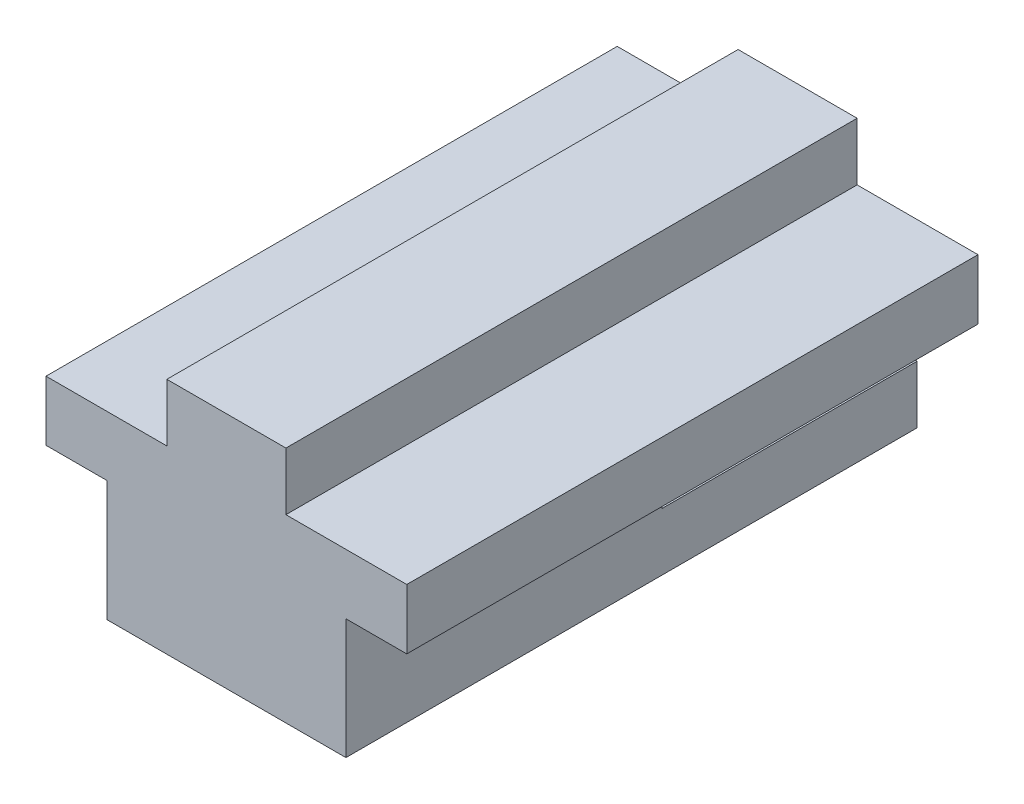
SolidWorks part; units mm, degrees
ref_plane "Front Plane" through (0, 0, 0) normal (0, 0, 1) x (1, 0, 0)
ref_plane "Top Plane" through (0, 0, 0) normal (0, 1, 0) x (1, 0, 0)
ref_plane "Right Plane" through (0, 0, 0) normal (1, 0, 0) x (0, 0, -1)
sketch "Sketch2" plane through (0, 0, 0) normal (0, 0, 1) x (1, 0, 0)
  line L0 (26.9748, 0) -> (33.401, 0)
  line L1 (-4.699, 0.0254) -> (1.7272, 0.0254)
  line L2 (-4.699, 0.0254) -> (-4.699, 6.35)
  line L3 (-4.699, 6.35) -> (8.0645, 6.35)
  line L4 (33.401, 0) -> (33.401, 6.35)
  line L5 (20.6375, 6.35) -> (33.401, 6.35)
  line L6 (1.7272, 0.0254) -> (1.7272, -12.7)
  line L7 (1.7272, -12.7) -> (26.9748, -12.7)
  line L8 (26.9748, 0) -> (26.9748, -12.7)
  line L9 (8.0645, 12.446) -> (20.6375, 12.446)
  line L10 (8.0645, 6.35) -> (8.0645, 12.446)
  line L12 (20.6375, 6.35) -> (20.6375, 12.446)
  dimension "D1" = 12.7635
  dimension "D2" = 38.1
  dimension "D3" = 25.2476
  dimension "D4" = 12.7
  dimension "D5" = 12.573
  dimension "D6" = 6.3373
  dimension "D7" = 6.3246
  dimension "D8" = 6.096
extrude "Boss-Extrude1" add sketch "Sketch2" against normal blind 60.325
sketch "Sketch3" plane through (0, -12.7, 0) normal (0, -1, 0) x (1, 0, 0)
  line L1 (1.7272, -60.325) -> (1.7272, 0) construction
  line L2 (1.7272, -60.325) -> (26.9748, -60.325) construction
  line L4 (1.7272, 0) -> (26.9748, 0) construction
  circle A0 centre (8.001, -15.875) radius 2.3876
  circle A1 centre (20.701, -15.875) radius 2.3876
  dimension "D1" = 4.7752
  dimension "D2" = 4.7752
  dimension "D5" = 44.45
  dimension "D6" = 15.875
  dimension "D3" = 12.7
  dimension "D4" = 6.2738
extrude "Cut-Extrude1" cut sketch "Sketch3" against normal blind 6.35
hole_wizard "#10-32 Tapped Hole1" positions "Sketch4" profile "Sketch5" tap size "#10-32" standard "ANSI Inch"
sketch "Sketch4" plane through (0, -12.7, 0) normal (0, -1, 0) x (-1, 0, 0)
  circle A2 centre (-8.001, 15.875) radius 2.3876 construction
  point P0 (-14.351, 4.7625)
  point P2 (-14.351, 26.9875)
  dimension "D2" = 11.1125
  dimension "D1" = 11.1125
  dimension "D3" = 6.35
  dimension "D4" = 6.35
sketch "Sketch5" plane through (14.351, -12.7, -4.7625) normal (1, 0, 0) x (0, 0, -1)
  line L0 (0, 0) -> (0, 13.1513)
  line L1 (0, 13.1513) -> (2.0193, 11.938)
  line L2 (2.0193, 11.938) -> (2.0193, 1.0287)
  line L3 (2.0193, 1.0287) -> (3.048, 0)
  line L5 (3.048, 0) -> (0, 0)
  line L6 (-2.0193, 1.0287) -> (-3.048, 0) construction
  line L10 (0, 13.1513) -> (-2.0193, 11.938) construction
  line L11 (0, -6.35) -> (0, 107.95) construction
  dimension "Tap Drill Dia." = 4.0386
  dimension "Tap Drill Depth" = 11.938
  dimension "Near C'Sink Dia." = 6.096
  dimension "Near C'Sink Angle" = 90
  dimension "Drill Angle" = 118
sketch "Sketch6" plane through (1.7272, 0, 0) normal (-1, 0, 0) x (0, 0, 1)
  line L0 (-60.325, 0.0254) -> (-60.325, -12.7) construction
  line L1 (-60.325, 0) -> (-33.401, 0)
  line L2 (-60.325, 0) -> (-60.325, -6.604)
  line L3 (-60.325, -6.604) -> (-33.401, -6.604)
  line L4 (-33.401, 0) -> (-33.401, -6.604)
  line L6 (-60.325, -12.7) -> (0, -12.7) construction
  dimension "D1" = 26.924
  dimension "D2" = 6.604
  dimension "D3" = 6.096
extrude "Cut-Extrude2" cut sketch "Sketch6" against normal through all both and the other way through all
hole_wizard "M7x1.0 Tapped Hole1" positions "Sketch7" profile "Sketch8" tap size "M7x1.0" standard "ANSI Metric"
sketch "Sketch7" plane through (0, -12.7, 0) normal (0, -1, 0) x (-1, 0, 0)
  line L0 (-1.7272, 60.325) -> (-1.7272, 0) construction
  circle A0 centre (-8.001, 15.875) radius 2.3876 construction
  circle A1 centre (-8.001, 15.875) radius 2.3876 construction
  point P0 (-14.351, 4.7625)
  point P2 (-14.351, 26.9875)
  dimension "D1" = 11.1125
  dimension "D2" = 11.1125
  dimension "D3" = 12.6238
  dimension "D4" = 12.6238
sketch "Sketch8" plane through (14.351, -12.7, -4.7625) normal (1, 0, 0) x (0, 0, -1)
  line L0 (0, 0) -> (0, 18.8206)
  line L1 (0, 18.8206) -> (3, 17.018)
  line L2 (3, 17.018) -> (3, 0)
  line L5 (3, 0) -> (0, 0)
  line L10 (0, 18.8206) -> (-3, 17.018) construction
  line L11 (0, -6.35) -> (0, 107.95) construction
  dimension "Tap Drill Dia." = 6
  dimension "Tap Drill Depth" = 17.018
  dimension "Drill Angle" = 118
